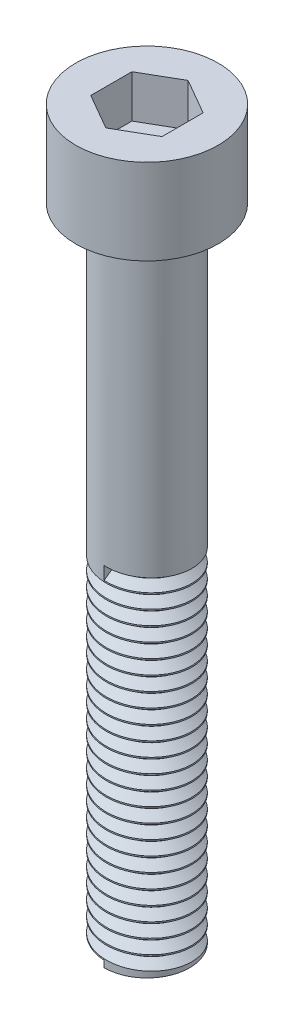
SolidWorks part; units mm, degrees
ref_plane "Alzado" through (0, 0, 0) normal (0, 0, 1) x (1, 0, 0)
ref_plane "Planta" through (0, 0, 0) normal (0, 1, 0) x (1, 0, 0)
ref_plane "Vista lateral" through (0, 0, 0) normal (1, 0, 0) x (0, 0, -1)
sketch "Sk_Cabeza" plane through (0, 0, 0) normal (0, 1, 0) x (1, 0, 0)
  circle A0 centre (0, 0) radius 5
  dimension "DIAM1" = 10
extrude "Cabeza" add sketch "Sk_Cabeza" along normal blind 6 from offset 0
sketch "Sk_Cana" plane through (0, 0, 0) normal (0, 1, 0) x (1, 0, 0)
  circle A0 centre (0, 0) radius 3
  dimension "DIAM2" = 6
extrude "Cana" add sketch "Sk_Cana" along normal blind 45 from offset 45
ref_plane "Plano_cabeza" through (0, 6, 0) normal (0, 1, 0) x (1, 0, 0)
sketch "Sk_Hueco_Allen" plane through (0, 6, 0) normal (0, 1, 0) x (1, 0, 0)
  line L0 (2.5, -1.4434) -> (0, -2.8868)
  line L1 (0, -2.8868) -> (-2.5, -1.4434)
  line L2 (-2.5, -1.4434) -> (-2.5, 1.4434)
  line L3 (-2.5, 1.4434) -> (0, 2.8868)
  line L4 (0, 2.8868) -> (2.5, 1.4434)
  line L5 (2.5, 1.4434) -> (2.5, -1.4434)
extrude "Hueco_Allen" cut sketch "Sk_Hueco_Allen" against normal blind 3
ref_plane "Plano_punta" through (0, -45, 0) normal (0, 1, 0) x (1, 0, 0)
sketch "Sk_Helice" plane through (0, -45, 0) normal (0, 1, 0) x (1, 0, 0)
  circle A0 centre (0, 0) radius 3
curve "Helice_rosca"
sketch "Sk_Perfil_rosca" plane through (0, 0, 0) normal (1, 0, 0) x (0, 0, -1)
  line L0 (-3.2, -45.6) -> (-2.3866, -45)
  line L1 (-2.3866, -45) -> (-3.2, -44.4)
  line L2 (-3.2, -44.4) -> (-3.2, -45.6)
sweep "Rosca_M6x1,0" cut profiles "Sk_Perfil_rosca" path "Helice_rosca"
